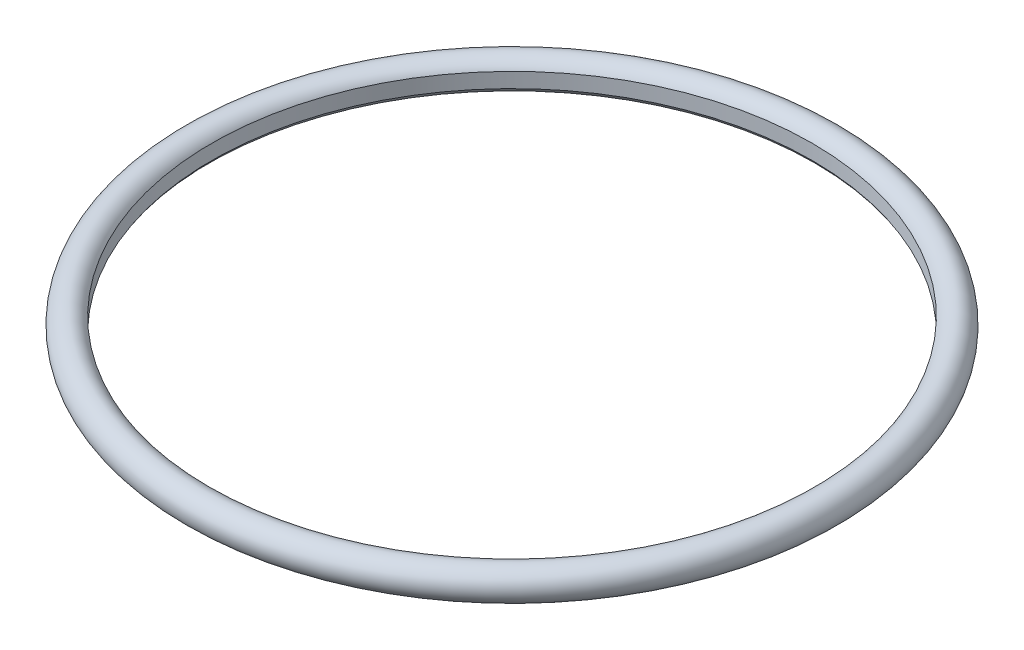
SolidWorks part; units mm, degrees
ref_plane "Piano frontale" through (0, 0, 0) normal (0, 0, 1) x (1, 0, 0)
ref_plane "Piano superiore" through (0, 0, 0) normal (0, 1, 0) x (1, 0, 0)
ref_plane "Piano destro" through (0, 0, 0) normal (1, 0, 0) x (0, 0, -1)
sketch "Schizzo1" plane through (0, 0, 0) normal (0, 0, 1) x (1, 0, 0)
  line L0 (0, 0) -> (0, 5) construction
  line L9 (23.9, 0.5937) -> (23.9, -0.5937)
  line L17 (0, 0) -> (25, 0) construction
  arc A0 (23.9, -0.5937) -> (23.9, 0.5937) centre (25, 0) ccw
  dimension "D4" = 2.5
  dimension "D1" = 23.9
  dimension "D5" = 25
revolve "Rivoluzione1" add sketch "Schizzo1" angle 360 about L0
